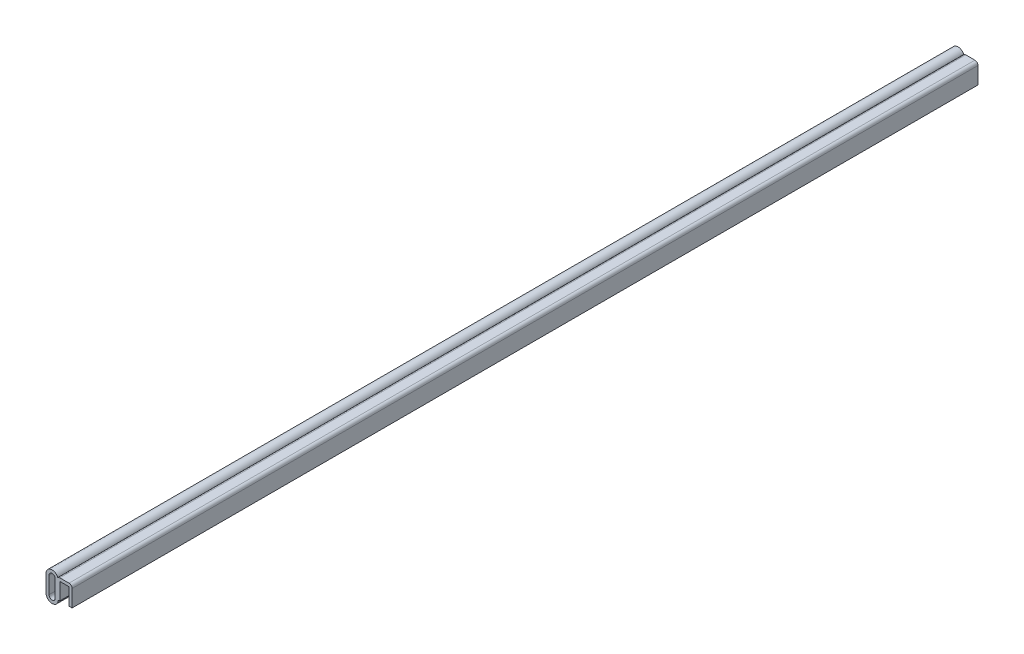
SolidWorks part; units mm, degrees
ref_plane "Plan de face" through (0, 0, 0) normal (0, 0, 1) x (1, 0, 0)
ref_plane "Plan de dessus" through (0, 0, 0) normal (0, 1, 0) x (1, 0, 0)
ref_plane "Plan de droite" through (0, 0, 0) normal (1, 0, 0) x (0, 0, -1)
sketch "Esquisse1" plane through (0, 0, 0) normal (0, 0, 1) x (1, 0, 0)
  line L1 (-5, -6.5) -> (5, -6.5) construction
  line L2 (-5, -6.5) -> (-5, 6.5)
  line L3 (-5, 6.5) -> (5, 6.5)
  line L4 (5, -6.5) -> (5, 6.5)
  line L5 (-5, -6.5) -> (5, 6.5) construction
  line L6 (-5, 6.5) -> (5, -6.5) construction
  point P0 (0, 0)
  dimension "D1" = 10
  dimension "D2" = 13
extrude "Extru.-Mince1" add sketch "Esquisse1" along normal mid plane 590 thin
fillet "Congé1" radius 2 2 edges at (-5, 6.5, 0) (5, 6.5, 0)
sketch "Esquisse2" plane through (0, 0, 0) normal (0, 0, 1) x (1, 0, 0)
  line L0 (-8, 4.5) -> (-8, -6.5) construction
  line L1 (-11, 4.5) -> (-11, -6.5) construction
  line L2 (-5, 4.5) -> (-5, -6.5) construction
  line L3 (-5, 4.5) -> (-5, -6.5) construction
  line L4 (-4, 4.5) -> (-4, -6.5)
  line L5 (-12, 4.5) -> (-12, -6.5)
  line L6 (-6, 4.5) -> (-6, -6.5)
  line L7 (-10, 4.5) -> (-10, -6.5)
  line L8 (-3, 4.5) -> (-3, -6.5) construction
  arc A0 (-11, 4.5) -> (-5, 4.5) centre (-8, 4.5) cw construction
  arc A1 (-11, -6.5) -> (-5, -6.5) centre (-8, -6.5) ccw construction
  arc A2 (-12, 4.5) -> (-4, 4.5) centre (-8, 4.5) cw
  arc A3 (-12, -6.5) -> (-4, -6.5) centre (-8, -6.5) ccw
  arc A4 (-10, 4.5) -> (-6, 4.5) centre (-8, 4.5) cw
  arc A5 (-10, -6.5) -> (-6, -6.5) centre (-8, -6.5) ccw
  dimension "D1" = 9
  dimension "D4" = 1
  dimension "D5" = 1
extrude "Boss.-Extru.1" add sketch "Esquisse2" along normal mid plane 590
sketch "Esquisse6" plane through (-3, 0, 0) normal (1, 0, 0) x (0, 0, -1)
  arc A0 (308, -9.4642) -> (295, 4.5) centre (294, -9.4642) ccw construction
  arc A1 (308, -9.4642) -> (295, 4.5) centre (294, -9.4642) ccw construction
sketch "Esquisse7" plane through (0, 0, -295) normal (0, 0, -1) x (-1, 0, 0)
  line L8 (3, -6.5) -> (4, -6.5)
  line L9 (12, -6.5) -> (12, 4.5)
  line L10 (3, 6.5) -> (-3, 6.5)
  line L11 (-5, 4.5) -> (-5, -6.5)
  line L12 (-5, -6.5) -> (-3, -6.5)
  line L13 (-3, -6.5) -> (-3, 4.5)
  line L14 (-3, 4.5) -> (3, 4.5)
  line L15 (3, 4.5) -> (3, -6.5)
  line L16 (3, -6.5) -> (4, -6.5)
  line L17 (12, -6.5) -> (12, 4.5)
  line L18 (3, 6.5) -> (-3, 6.5)
  line L19 (-5, 4.5) -> (-5, -6.5)
  line L20 (-5, -6.5) -> (-3, -6.5)
  line L21 (-3, -6.5) -> (-3, 4.5)
  line L22 (-3, 4.5) -> (3, 4.5)
  line L23 (3, 4.5) -> (3, -6.5)
  arc A4 (4, -6.5) -> (12, -6.5) centre (8, -6.5) ccw
  arc A5 (12, 4.5) -> (4.3, 6.0199) centre (8, 4.5) ccw
  arc A6 (4.3, 6.0199) -> (3, 6.5) centre (3, 4.5) ccw
  arc A7 (-3, 6.5) -> (-5, 4.5) centre (-3, 4.5) ccw
  arc A8 (4, -6.5) -> (12, -6.5) centre (8, -6.5) ccw
  arc A9 (12, 4.5) -> (4.3, 6.0199) centre (8, 4.5) ccw
  arc A10 (4.3, 6.0199) -> (3, 6.5) centre (3, 4.5) ccw
  arc A11 (-3, 6.5) -> (-5, 4.5) centre (-3, 4.5) ccw
  dimension "D1" = 0
